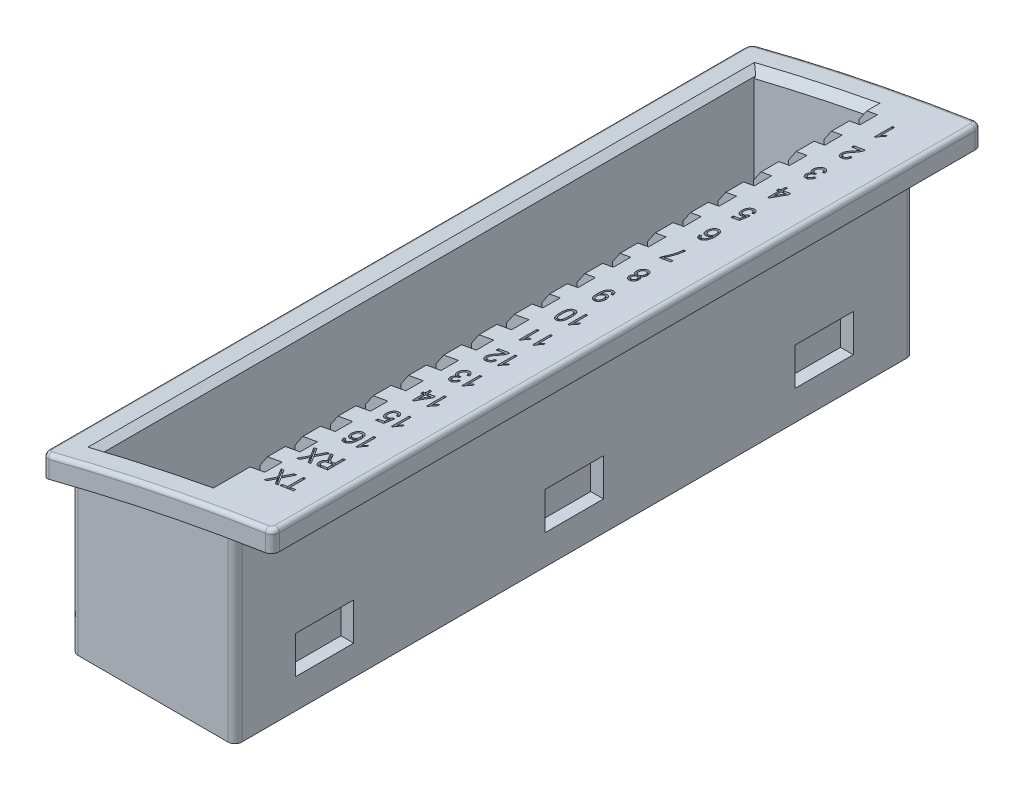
SolidWorks part; units mm, degrees
ref_plane "Front Plane" through (0, 0, 0) normal (0, 0, 1) x (1, 0, 0)
ref_plane "Top Plane" through (0, 0, 0) normal (0, 1, 0) x (1, 0, 0)
ref_plane "Right Plane" through (0, 0, 0) normal (1, 0, 0) x (0, 0, -1)
sketch "Sketch1" plane through (0, 0, 0) normal (0, 0, 1) x (1, 0, 0)
  line L0 (9.7211, 14.3502) -> (9.7193, 15.867)
  line L1 (-6.9049, 10.9118) -> (-6.9049, 12.4622)
  line L2 (6.8, 0) -> (-6.8, 0) construction
  line L3 (1.3625, 12.8514) -> (1.3625, 14.3829) construction
  arc A0 (9.7211, 14.3502) -> (-6.9049, 10.9118) centre (33.7964, -143.9799) ccw
  arc A3 (9.7193, 15.867) -> (-6.9049, 12.4622) centre (33.7964, -143.9799) ccw
  dimension "D1" = 160.15
  dimension "D3" = 161.65
  dimension "D2" = 12.8514
  dimension "D4" = 1.5168
  dimension "D5" = 1.5504
  dimension "D6" = 1.3625
extrude "Extrude1" add sketch "Sketch1" along normal mid plane 51.12
sketch "Sketch2" plane through (0, 0, 0) normal (0, 1, 0) x (1, 0, 0)
  line L0 (-5.9, -24.46) -> (5.9, -24.46)
  line L1 (5.9, 24.46) -> (5.9, -24.46)
  line L2 (5.9, 24.46) -> (-5.9, 24.46)
  line L3 (-5.9, 24.46) -> (-5.9, -24.46)
  line L4 (-5.9, 0) -> (5.9, 0) construction
  dimension "D1" = 11.8
  dimension "D2" = 48.92
extrude "Extrude2" add sketch "Sketch2" along normal up to surface (13.7218 mm away)
sketch "Sketch3" plane through (0, 0, 24.46) normal (0, 0, 1) x (1, 0, 0)
  line L0 (-5.9, 10.9118) -> (-6.9049, 10.9118)
  line L1 (-5.9, 11.1724) -> (-5.9, 0) construction
  line L2 (-5.9, 10.9118) -> (-5.9, 11.3118)
  line L3 (-5.9, 11.3118) -> (-6.9049, 10.9118)
  dimension "D1" = 0.4
extrude "Extrude4" add sketch "Sketch3" against normal up to surface (48.92 mm away)
sketch "Sketch4" plane through (0, 0, 0) normal (0, -1, 0) x (1, 0, 0)
  line L0 (3.35, -23.4426) -> (-4.5827, -23.4426)
  line L1 (3.35, -23.4426) -> (3.35, 23.4427)
  line L2 (3.35, 23.4427) -> (-4.5827, 23.4427)
  line L3 (-4.5827, -23.4426) -> (-4.5827, 23.4427)
  line L4 (-5.9, -24.46) -> (-5.9, 24.46) construction
  line L5 (-5.9, 24.46) -> (5.9, 24.46) construction
  dimension "D1" = 7.9327
  dimension "D2" = 46.8853
  dimension "D3" = 1.3173
  dimension "D4" = 1.0173
extrude "Cut-Extrude1" cut sketch "Sketch4" against normal up to surface (13.048 mm away)
fillet "Fillet1" radius 0.5 4 edges at (5.9, 6.8609, -24.46) (-5.9, 5.4559, -24.46) (-5.9, 5.4559, 24.46) (5.9, 6.8609, 24.46)
fillet "Fillet2" radius 0.5 4 edges at (9.7202, 15.1086, -25.56) (-6.9049, 11.687, -25.56) (-6.9049, 11.687, 25.56) (9.7202, 15.1086, 25.56)
fillet "Fillet3" radius 0.3 8 edges at (9.5344, 15.839, 25.4483) (9.7193, 15.867, 0) (9.6119, 15.8508, -25.3698) (1.3678, 14.384, -25.56) (-6.7251, 12.5089, -25.444) (-6.9049, 12.4622, 0) (-6.8013, 12.4891, 25.3648) (1.3678, 14.384, 25.56)
chamfer "Chamfer1" distance 0.5673 angle 45 4 edges at (-4.5827, 13.048, 0.0001) (-0.6272, 13.9623, 23.4427) (3.35, 14.777, 0.0001) (-0.6272, 13.9623, -23.4426)
sketch "Sketch6" plane through (-5.9, 0, 0) normal (-1, 0, 0) x (0, 0, 1)
  line L0 (-11.9, 4.8417) -> (-6.1, 4.8417)
  line L1 (-11.9, 2.1416) -> (-11.9, 4.8417)
  line L2 (-11.9, 2.1416) -> (-6.1, 2.1416)
  line L3 (-6.1, 4.8417) -> (-6.1, 2.1416)
  line L4 (-9, 2.1416) -> (-9, 0) construction
  line L5 (-23.96, 0) -> (23.96, 0) construction
  line L6 (0, 0) -> (0, 8.2117) construction
  line L8 (6.1, 4.8417) -> (6.1, 2.1416)
  line L9 (11.9, 4.8417) -> (6.1, 4.8417)
  line L10 (11.9, 2.1416) -> (11.9, 4.8417)
  line L11 (11.9, 2.1416) -> (6.1, 2.1416)
  point P2 (0, 0)
  dimension "D1" = 2.1416
  dimension "D2" = 5.8
  dimension "D3" = 2.7001
  dimension "D4" = 6.1
extrude "Cut-Extrude3" cut sketch "Sketch6" against normal blind 0.9687
sketch "Sketch7" plane through (5.9, 0, 0) normal (1, 0, 0) x (0, 0, -1)
  line L0 (2.1, 4.8422) -> (2.1, 2.1421)
  line L1 (-2.1, 4.8422) -> (2.1, 4.8422)
  line L2 (-2.1, 2.1421) -> (2.1, 2.1421)
  line L3 (-2.1, 2.1421) -> (-2.1, 4.8422)
  line L4 (15.9, 2.1421) -> (15.9, 4.8422)
  line L5 (0, 2.1421) -> (0, 0) construction
  line L6 (0, 0) -> (0, 13.7218) construction
  line L7 (-23.96, 0) -> (23.96, 0) construction
  line L8 (-20.1, 4.8422) -> (-20.1, 2.1421)
  line L9 (-23.96, 13.7218) -> (23.96, 13.7218) construction
  line L10 (15.9, 4.8422) -> (20.1, 4.8422)
  line L11 (15.9, 2.1421) -> (20.1, 2.1421)
  line L12 (20.1, 4.8422) -> (20.1, 2.1421)
  line L13 (-15.9, 4.8422) -> (-20.1, 4.8422)
  line L14 (-15.9, 2.1421) -> (-15.9, 4.8422)
  line L15 (-15.9, 2.1421) -> (-20.1, 2.1421)
  point P7 (0, 0)
  dimension "D1" = 4.2
  dimension "D2" = 2.7001
  dimension "D3" = 2.1421
  dimension "D4" = 13.8
extrude "Cut-Extrude4" cut sketch "Sketch7" against normal blind 0.9187
sketch "Sketch8" plane through (0, 0, 0) normal (0, -1, 0) x (1, 0, 0)
  line L0 (4.6814, 21.3714) -> (3.35, 21.3714)
  line L1 (3.35, 20.1152) -> (4.6814, 20.1152)
  line L2 (4.6814, 21.3714) -> (4.6814, 20.1152)
  line L3 (-5.4, 24.46) -> (5.4, 24.46) construction
  line L4 (5.9, 23.96) -> (5.9, -23.96) construction
  line L5 (4.6814, 21.3714) -> (4.6814, 24.46) construction
  line L6 (4.6814, 20.7433) -> (5.9, 20.7433) construction
  line L7 (3.35, 21.3714) -> (3.35, 20.1152)
  line L8 (3.35, -23.4426) -> (3.35, 23.4427) construction
  dimension "D1" = 1.2186
  dimension "D2" = 3.0886
  dimension "D3" = 1.2562
chamfer "Chamfer2" distance 0.5673 angle 45 4 edges at (3.35, 0, 0.0001) (-0.6164, 0, 23.4427) (-4.5827, 0, 0.0001) (-0.6164, 0, -23.4426)
extrude "Cut-Extrude6" cut sketch "Sketch8" against normal up to surface (15.0265 mm away)
pattern_linear "LPattern1" count 18 spacing 2.54 along (0, 0, -1) of "Cut-Extrude6"
sketch "Sketch9" plane through (0, 0, 25.56) normal (0, 0, 1) x (1, 0, 0)
  arc A0 (-6.4049, 12.5914) -> (9.2194, 15.7909) centre (33.7964, -143.9799) ccw construction
  point P0 (7.0615, 15.444)
ref_plane "Plane1" through (7.0615, 15.444, 25.26) normal (-0.1654, 0.9862, 0) x (-0.9862, -0.1654, 0)
sketch "Sketch10"
  dimension "D1" = 2.5444
extrude "Cut-Extrude7" cut sketch "Sketch10" against normal blind 0.2
chamfer "Chamfer3" distance 0.2904 angle 45 8 edges at (4.6814, 15.0265, 20.7433) (4.6814, 15.0265, 18.2033) (4.6814, 15.0265, 15.6633) (4.6814, 15.0265, 13.1233) (4.6814, 15.0265, 10.5833) (4.6814, 15.0265, 8.0433) (4.6814, 15.0265, 5.5033) (4.6814, 15.0265, 2.9633)
